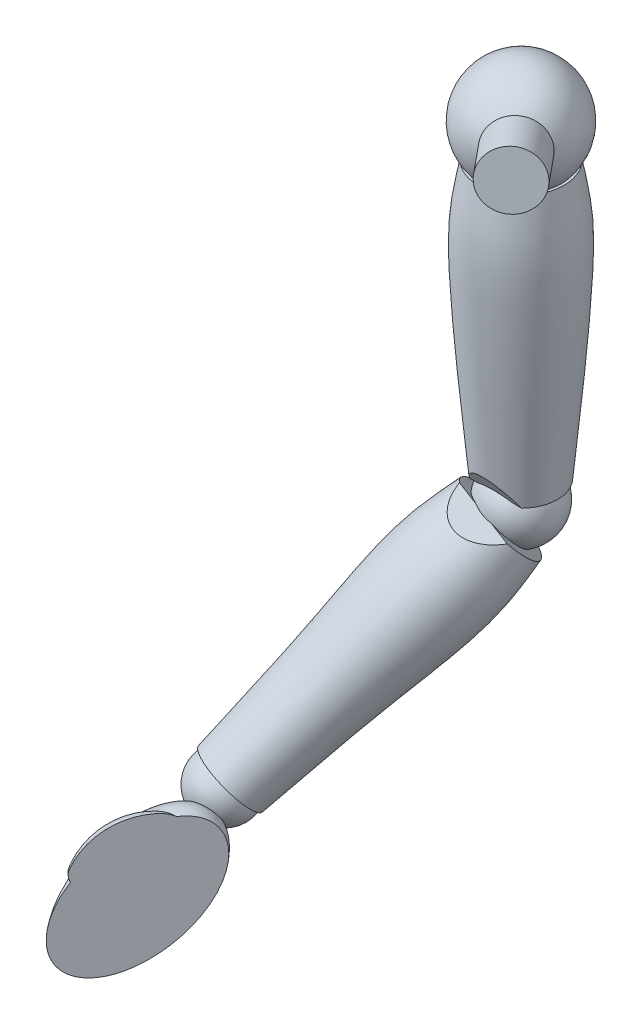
SolidWorks part; units mm, degrees
ref_plane "Plano frontal" through (0, 0, 0) normal (0, 0, 1) x (1, 0, 0)
ref_plane "Plano superior" through (0, 0, 0) normal (0, 1, 0) x (1, 0, 0)
ref_plane "Plano direito" through (0, 0, 0) normal (1, 0, 0) x (0, 0, -1)
imported_body "SW3dPS-manikin_Upper Arm-1-solid1"
imported_body "SW3dPS-manikin_Forearm-1-solid1"
imported_body "SW3dPS-manikin_Shoulder-1-solid1"
imported_body "SW3dPS-manikin_Rignt Hand-1-solid1"
combine bodies "Combinar1" operation type add bodies to combine 101 102 103 104
scale "Escala1" scale about centroid uniform scaling yes scale factor 6
sketch "Esboço1" plane through (22.1611, 2.8969, 16.4629) normal (0.7984, 0.1044, 0.5931) x (0.5881, 0.0769, -0.8051)
  line L0 (-192.138, -253.5873) -> (-298.7171, -351.2189) construction
  spline S0 degree 3 number of poles 130 (-287.1985, -284.6766) -> (-212.47, -247.4223) construction
ref_plane "Plano1" through (28.1915, -38.8561, -31.1118) normal (-0.4928, 0.6792, 0.5439) x (-0.8701, -0.3847, -0.308)
sketch "Esboço2" plane through (28.1915, -38.8561, -31.1118) normal (-0.4928, 0.6792, 0.5439) x (-0.8701, -0.3847, -0.308)
  line L0 (127.7533, 364.4989) -> (68.9268, 389.9998) construction
  line L1 (99.0098, 298.1923) -> (156.4967, 430.8055) construction
